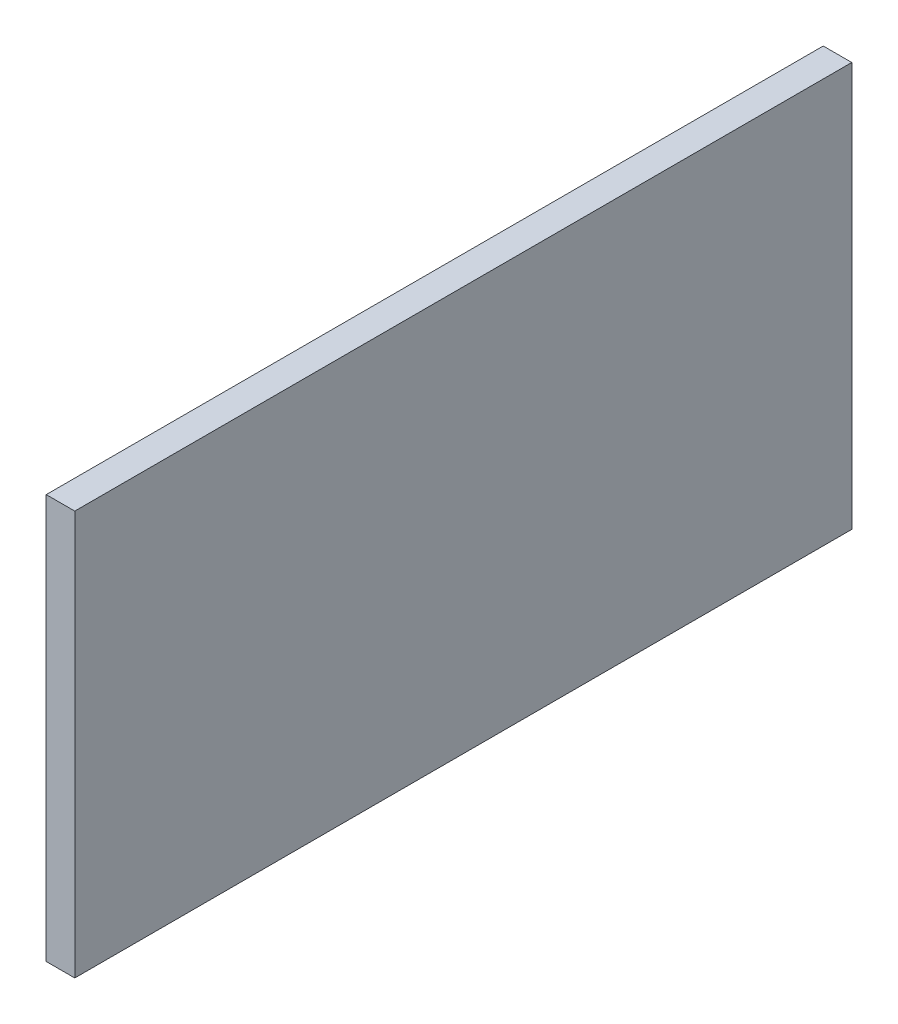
SolidWorks part; units mm, degrees
ref_plane "Plano frontal" through (0, 0, 0) normal (0, 0, 1) x (1, 0, 0)
ref_plane "Plano superior" through (0, 0, 0) normal (0, 1, 0) x (1, 0, 0)
ref_plane "Plano direito" through (0, 0, 0) normal (1, 0, 0) x (0, 0, -1)
sketch "Esboço2" plane through (0, 0, 0) normal (0, 0, 1) x (1, 0, 0)
  line L0 (263, -18) -> (263, 49982) construction
  line L1 (281, -18) -> (281, 49982) construction
  line L3 (-719.0211, 677.5) -> (49280.9789, 677.5) construction
  line L4 (-719.0211, 932.5) -> (49280.9789, 932.5) construction
  line L5 (263, 932.5317) -> (281, 932.5317)
  line L6 (263, 932.5317) -> (263, 677.5317)
  line L7 (263, 677.5317) -> (281, 677.5317)
  line L8 (281, 932.5317) -> (281, 677.5317)
  point P3 (263, 677.5317)
  point P4 (281, 677.5317)
  dimension "D1" = 255
extrude "Ressalto-extrusão1" add sketch "Esboço2" against normal blind 490
